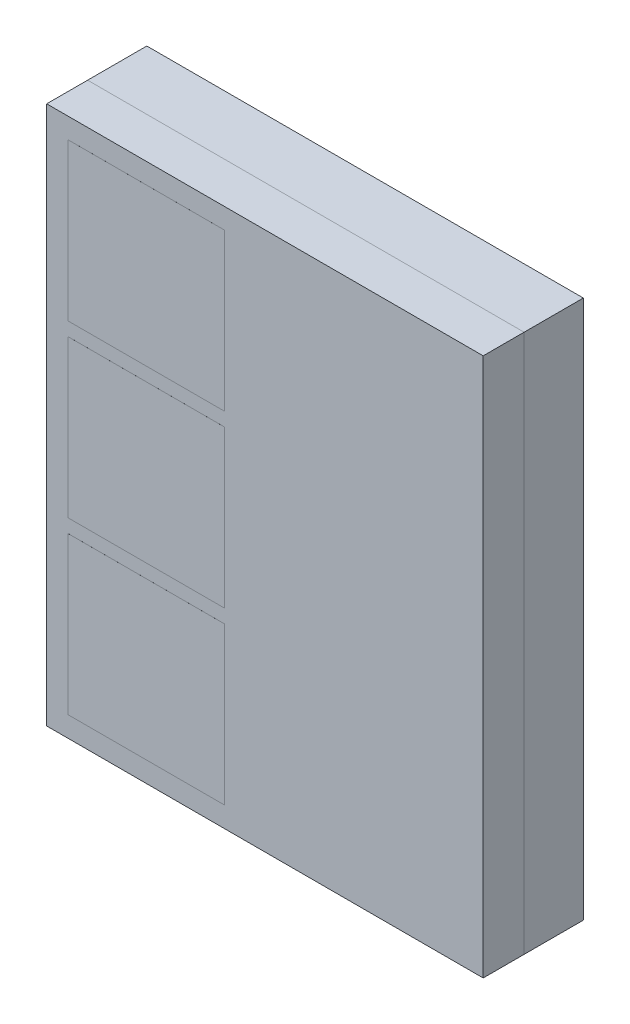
SolidWorks part; units mm, degrees
ref_plane "前视基准面" through (0, 0, 0) normal (0, 0, 1) x (1, 0, 0)
ref_plane "上视基准面" through (0, 0, 0) normal (0, 1, 0) x (1, 0, 0)
ref_plane "右视基准面" through (0, 0, 0) normal (1, 0, 0) x (0, 0, -1)
sketch "草图1" plane through (0, 0, 0) normal (0, 0, 1) x (1, 0, 0)
  line L0 (-0.575, 0.675) -> (0.575, 0.675)
  line L1 (-0.575, -0.575) -> (0.575, -0.575)
  line L2 (-0.575, -0.575) -> (-0.575, 0.575)
  line L3 (-0.575, 0.575) -> (0.575, 0.575)
  line L4 (0.575, -0.575) -> (0.575, 0.575)
  line L5 (-0.575, -0.575) -> (0.575, 0.575) construction
  line L6 (-0.575, 0.575) -> (0.575, -0.575) construction
  line L11 (-0.575, 1.825) -> (0.575, 1.825)
  line L12 (-0.575, 0.675) -> (-0.575, 1.825)
  line L17 (0.575, 0.675) -> (0.575, 1.825)
  line L18 (-0.575, 0.675) -> (0.575, 1.825) construction
  line L19 (-0.575, 1.825) -> (0.575, 0.675) construction
  line L20 (-0.575, -1.825) -> (0.575, -1.825)
  line L21 (-0.575, -0.675) -> (0.575, -0.675)
  line L22 (-0.575, -1.825) -> (-0.575, -0.675)
  line L23 (0.575, -1.825) -> (0.575, -0.675)
  line L24 (-0.575, -1.825) -> (0.575, -0.675) construction
  line L25 (-0.575, -0.675) -> (0.575, -1.825) construction
  point P0 (0, 0)
  point P6 (0, 1.25)
  point P11 (0, -1.25)
  dimension "D1" = 1.15
  dimension "D2" = 1.15
  dimension "D3" = 1.15
  dimension "D4" = 1.15
extrude "凸台-拉伸1" add sketch "草图1" along normal blind 0.0001
sketch "草图2" plane through (0, 0, 0) normal (0, 0, -1) x (-1, 0, 0)
  line L1 (0.73, -1.975) -> (-2.47, -1.975)
  line L2 (0.73, -1.975) -> (0.73, 1.975)
  line L3 (0.73, 1.975) -> (-2.47, 1.975)
  line L4 (-2.47, -1.975) -> (-2.47, 1.975)
  line L5 (0.73, -1.975) -> (-2.47, 1.975) construction
  line L6 (0.73, 1.975) -> (-2.47, -1.975) construction
  point P0 (-0.87, 0)
  point P5 (0, 0)
  point P8 (-0.87, 0.2684)
  point P11 (0, 0)
  point P12 (0.6325, -0.283)
  dimension "D1" = 3.2
  dimension "D2" = 3.95
  dimension "D3" = 0.87
  dimension "D4" = 0
extrude "凸台-拉伸2" add sketch "草图2" along normal blind 0.3 separate body
sketch "草图3" plane through (0, 0, -0.3) normal (0, 0, -1) x (-1, 0, 0)
  line L1 (0.73, -1.975) -> (-2.47, -1.975)
  line L2 (0.73, -1.975) -> (0.73, 1.975)
  line L3 (0.73, 1.975) -> (-2.47, 1.975)
  line L4 (-2.47, -1.975) -> (-2.47, 1.975)
  line L5 (0.73, -1.975) -> (-2.47, 1.975) construction
  line L6 (0.73, 1.975) -> (-2.47, -1.975) construction
  point P0 (-0.87, 0)
  point P6 (0.73, -1.975)
extrude "凸台-拉伸3" add sketch "草图3" along normal blind 0.434 separate body
sketch "草图4" plane through (0, 0, -0.734) normal (0, 0, -1) x (-1, 0, 0)
  line L0 (0.73, 1.975) -> (-2.47, 1.975) construction
  line L1 (-1.32, 0.145) -> (-1.99, 0.145)
  line L2 (-1.02, 0.445) -> (-1.02, 1.345)
  line L3 (-1.32, 1.645) -> (-1.99, 1.645)
  line L4 (-2.29, 0.445) -> (-2.29, 1.345)
  line L5 (-1.02, 0.145) -> (-2.29, 1.645) construction
  line L6 (-1.02, 1.645) -> (-2.29, 0.145) construction
  line L7 (-2.47, 1.975) -> (-2.47, -1.975) construction
  line L8 (-1.0039, -1.345) -> (-1.0039, -0.5149)
  line L9 (-1.4039, -0.1149) -> (-1.99, -0.1149)
  line L10 (-1.3039, -1.645) -> (-1.99, -1.645)
  line L11 (-2.29, -1.345) -> (-2.29, -0.4149)
  line L12 (-1.0039, -1.645) -> (-2.29, -0.1149) construction
  line L13 (-1.0039, -0.1149) -> (-2.29, -1.645) construction
  line L14 (0.55, -1.345) -> (0.55, -0.445)
  line L15 (0.25, -0.145) -> (-0.42, -0.145)
  line L16 (0.25, -1.645) -> (-0.42, -1.645)
  line L17 (-0.72, -1.345) -> (-0.72, -0.445)
  line L18 (0.55, -1.645) -> (-0.72, -0.145) construction
  line L19 (0.55, -0.145) -> (-0.72, -1.645) construction
  line L20 (0.55, 0.445) -> (0.55, 1.345)
  line L21 (0.25, 1.645) -> (-0.4238, 1.645)
  line L22 (0.25, 0.145) -> (-0.4238, 0.145)
  line L23 (-0.7238, 0.445) -> (-0.7238, 1.345)
  line L24 (0.55, 0.145) -> (-0.7238, 1.645) construction
  line L25 (0.55, 1.645) -> (-0.7238, 0.145) construction
  line L26 (0.73, -1.975) -> (0.73, 1.975) construction
  line L27 (-2.47, -1.975) -> (0.73, -1.975) construction
  line L28 (-1.0039, -0.5149) -> (-1.4039, -0.1149)
  arc A0 (-1.99, 1.645) -> (-2.29, 1.345) centre (-1.99, 1.345) ccw
  arc A1 (-2.29, 0.445) -> (-1.99, 0.145) centre (-1.99, 0.445) ccw
  arc A2 (-1.32, 0.145) -> (-1.02, 0.445) centre (-1.32, 0.445) ccw
  arc A3 (-1.02, 1.345) -> (-1.32, 1.645) centre (-1.32, 1.345) ccw
  arc A4 (-1.3039, -1.645) -> (-1.0039, -1.345) centre (-1.3039, -1.345) ccw
  arc A6 (-1.99, -0.1149) -> (-2.29, -0.4149) centre (-1.99, -0.4149) ccw
  arc A7 (-2.29, -1.345) -> (-1.99, -1.645) centre (-1.99, -1.345) ccw
  arc A8 (0.25, -1.645) -> (0.55, -1.345) centre (0.25, -1.345) ccw
  arc A9 (0.55, -0.445) -> (0.25, -0.145) centre (0.25, -0.445) ccw
  arc A10 (-0.42, -0.145) -> (-0.72, -0.445) centre (-0.42, -0.445) ccw
  arc A11 (-0.72, -1.345) -> (-0.42, -1.645) centre (-0.42, -1.345) ccw
  arc A12 (0.25, 0.145) -> (0.55, 0.445) centre (0.25, 0.445) ccw
  arc A13 (0.55, 1.345) -> (0.25, 1.645) centre (0.25, 1.345) ccw
  arc A14 (-0.4238, 1.645) -> (-0.7238, 1.345) centre (-0.4238, 1.345) ccw
  arc A15 (-0.7238, 0.445) -> (-0.4238, 0.145) centre (-0.4238, 0.445) ccw
  point P0 (-1.655, 0.895)
  point P21 (-1.647, -0.88)
  point P35 (-1.0541, -0.1149)
  point P37 (-1.0039, -0.145)
  point P38 (-0.085, -0.895)
  point P55 (-0.0869, 0.895)
  dimension "D3" = 0.3
  dimension "D1" = 1.27
  dimension "D2" = 1.5
  dimension "D4" = 0.33
  dimension "D5" = 0.18
  dimension "D6" = 0.33
  dimension "D7" = 0.9
  dimension "D8" = 0.18
  dimension "D9" = 0.18
  dimension "D10" = 0.33
  dimension "D11" = 0.33
  dimension "D12" = 0.9
  dimension "D13" = 0.18
extrude "凸台-拉伸4" add sketch "草图4" along normal blind 0.056 separate body
